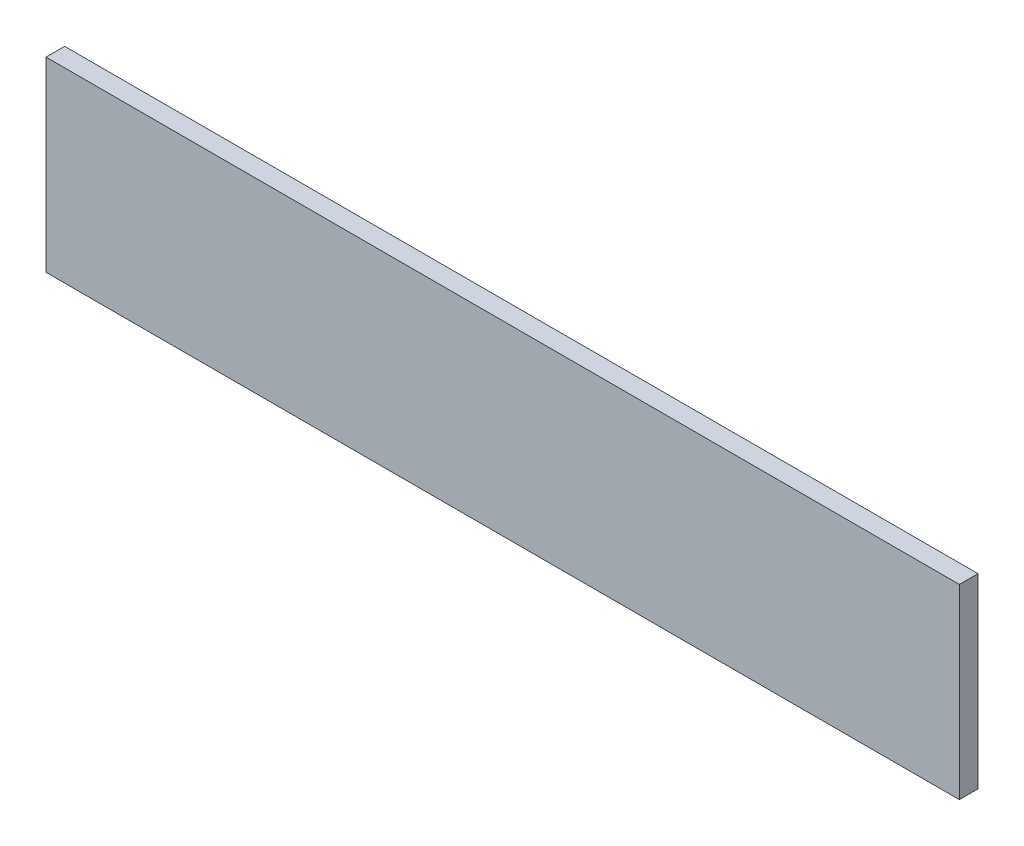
SolidWorks part; units mm, degrees
ref_plane "Front Plane" through (0, 0, 0) normal (0, 0, 1) x (1, 0, 0)
ref_plane "Top Plane" through (0, 0, 0) normal (0, 1, 0) x (1, 0, 0)
ref_plane "Right Plane" through (0, 0, 0) normal (1, 0, 0) x (0, 0, -1)
sketch "Sketch1" plane through (0, 0, 0) normal (0, 0, 1) x (1, 0, 0)
  line L0 (0, 51.1851) -> (0, -64.4048) construction
  line L1 (-77.6607, 0) -> (90.3032, 0) construction
  line L3 (-245, 50) -> (245, 50)
  line L4 (-245, 50) -> (-245, -50)
  line L5 (-245, -50) -> (245, -50)
  line L6 (245, 50) -> (245, -50)
  line L7 (-245, 50) -> (245, -50) construction
  line L8 (-245, -50) -> (245, 50) construction
  point P5 (0, 0)
  dimension "D1" = 100
  dimension "D2" = 490
extrude "Boss-Extrude1" add sketch "Sketch1" along normal blind 10
